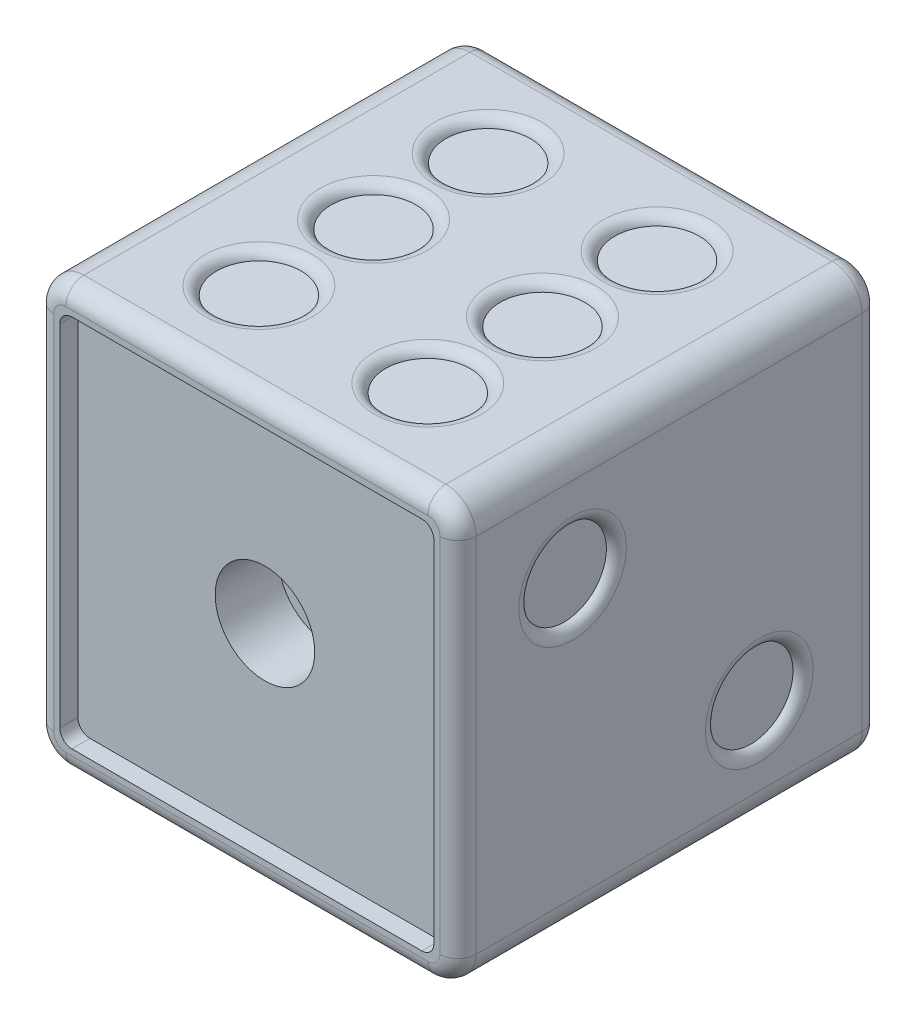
SolidWorks part; units mm, degrees
ref_plane "Front Plane" through (0, 0, 0) normal (0, 0, 1) x (1, 0, 0)
ref_plane "Top Plane" through (0, 0, 0) normal (0, 1, 0) x (1, 0, 0)
ref_plane "Right Plane" through (0, 0, 0) normal (1, 0, 0) x (0, 0, -1)
sketch "Sketch1" plane through (0, 0, 0) normal (0, 0, 1) x (1, 0, 0)
  line L1 (17.5, -17.5) -> (-17.5, -17.5)
  line L2 (17.5, -17.5) -> (17.5, 17.5)
  line L3 (17.5, 17.5) -> (-17.5, 17.5)
  line L4 (-17.5, -17.5) -> (-17.5, 17.5)
  line L5 (17.5, -17.5) -> (-17.5, 17.5) construction
  line L6 (17.5, 17.5) -> (-17.5, -17.5) construction
  point P0 (0, 0)
  dimension "D1" = 35
  dimension "D2" = 35
extrude "Boss-Extrude1" add sketch "Sketch1" along normal blind 35
sketch "Sketch2" plane through (0, 0, 35) normal (0, 0, 1) x (1, 0, 0)
  line L1 (15.5, -15.5) -> (-15.5, -15.5)
  line L2 (15.5, -15.5) -> (15.5, 15.5)
  line L3 (15.5, 15.5) -> (-15.5, 15.5)
  line L4 (-15.5, -15.5) -> (-15.5, 15.5)
  line L5 (15.5, -15.5) -> (-15.5, 15.5) construction
  line L6 (15.5, 15.5) -> (-15.5, -15.5) construction
  point P0 (0, 0)
  dimension "D1" = 31
  dimension "D2" = 31
extrude "Cut-Extrude1" cut sketch "Sketch2" against normal blind 1.5
fillet "Fillet1" radius 1 4 edges at (-15.5, -15.5, 34.25) (15.5, -15.5, 34.25) (15.5, 15.5, 34.25) (-15.5, 15.5, 34.25)
sketch "Sketch11" plane through (0, 0, 33.5) normal (0, 0, 1) x (1, 0, 0)
  circle A0 centre (0, 0) radius 4.125
  dimension "D1" = 8.25
extrude "Cut-Extrude6" cut sketch "Sketch11" against normal blind 5.25
fillet "Fillet3" radius 2.5 4 edges at (-17.5, 17.5, 17.5) (17.5, 17.5, 17.5) (17.5, -17.5, 17.5) (-17.5, -17.5, 17.5)
fillet "Fillet4" radius 1.5 16 edges at (-16.7678, -16.7678, 0) (-17.5, 0, 0) (-16.7678, 16.7678, 0) (0, 17.5, 0) (16.7678, 16.7678, 0) (17.5, 0, 0) (16.7678, -16.7678, 0) (0, -17.5, 0) (-16.7678, -16.7678, 35) (-17.5, 0, 35) (-16.7678, 16.7678, 35) (0, 17.5, 35) (16.7678, 16.7678, 35) (17.5, 0, 35) (16.7678, -16.7678, 35) (0, -17.5, 35)
sketch "Sketch13" plane through (0, -17.5, 0) normal (0, -1, 0) x (1, 0, 0)
  line L0 (-15, 17.5) -> (15, 17.5) construction
  line L1 (-15, 33.5) -> (-15, 1.5) construction
  line L2 (15, 1.5) -> (15, 33.5) construction
  circle A0 centre (0, 17.5) radius 3.5
  dimension "D1" = 7
extrude "1" cut sketch "Sketch13" against normal blind 0.7
sketch "Sketch15" plane through (0, 0, 0) normal (0, 0, -1) x (-1, 0, 0)
  line L0 (-16, 0) -> (16, 0) construction
  line L1 (-16, 15) -> (-16, -15) construction
  line L2 (16, -15) -> (16, 15) construction
  line L3 (0, 16) -> (0, -16) construction
  line L4 (15, 16) -> (-15, 16) construction
  line L5 (-15, -16) -> (15, -16) construction
  circle A0 centre (0, 0) radius 3.5
  circle A1 centre (-8, 9) radius 3.5
  circle A2 centre (-8, -9) radius 3.5
  circle A3 centre (8, -9) radius 3.5
  circle A4 centre (8, 9) radius 3.5
  dimension "D1" = 7
  dimension "D2" = 7
  dimension "D3" = 8
  dimension "D4" = 7
extrude "5" cut sketch "Sketch15" against normal blind 0.7
sketch "Sketch16" plane through (-17.5, 0, 0) normal (-1, 0, 0) x (0, 0, 1)
  line L0 (1.5, -15) -> (33.5, 15) construction
  line L1 (1.5, 15) -> (1.5, -15) construction
  line L2 (33.5, 15) -> (1.5, 15) construction
  circle A0 centre (17.5, 0) radius 3.5
  circle A1 centre (9.5, 8) radius 3.5
  circle A2 centre (24.9678, -8.499) radius 3.5
  dimension "D1" = 7
  dimension "D2" = 7
  dimension "D3" = 8
  dimension "D4" = 7
extrude "3" cut sketch "Sketch16" against normal blind 0.7
sketch "Sketch17" plane through (0, 17.5, 0) normal (0, 1, 0) x (1, 0, 0)
  line L0 (0, -1.5) -> (0, -33.5) construction
  line L1 (15, -1.5) -> (-15, -1.5) construction
  line L2 (-15, -33.5) -> (15, -33.5) construction
  line L3 (-15, -17.5) -> (15, -17.5) construction
  line L4 (-15, -1.5) -> (-15, -33.5) construction
  line L5 (15, -33.5) -> (15, -1.5) construction
  circle A0 centre (-7, -8) radius 3.5
  circle A1 centre (-7, -17.5) radius 3.5
  circle A2 centre (-7, -27) radius 3.5
  circle A3 centre (7, -27) radius 3.5
  circle A4 centre (7, -17.5) radius 3.5
  circle A5 centre (7, -8) radius 3.5
  dimension "D1" = 7
  dimension "D2" = 7
  dimension "D3" = 6.5
  dimension "D4" = 8
  dimension "D5" = 8
extrude "6" cut sketch "Sketch17" against normal blind 0.7
sketch "Sketch18" plane through (17.5, 0, 0) normal (1, 0, 0) x (0, 0, -1)
  line L0 (-1.5, 15) -> (-33.5, 15) construction
  line L1 (-33.5, 15) -> (-33.5, -15) construction
  line L2 (-1.5, 15) -> (-33.5, -15) construction
  circle A0 centre (-25.5, 8) radius 3.5
  circle A1 centre (-10.0322, -8.499) radius 3.5
  dimension "D1" = 7
  dimension "D2" = 7
  dimension "D3" = 8
extrude "4" cut sketch "Sketch18" against normal blind 0.7
fillet "Fillet5" radius 1 17 edges at (-17.5, -8.499, 21.4678) (-17.5, 0, 21) (-17.5, 8, 13) (-10.5, 17.5, 8) (10.5, 17.5, 8) (-10.5, 17.5, 17.5) (10.5, 17.5, 17.5) (-3.5, 17.5, 27) (3.5, 17.5, 27) (-4.5, 9, 0) (-11.5, -9, 0) (-3.5, 0, 0) (4.5, 9, 0) (11.5, -9, 0) (17.5, -11.999, 10.0322) (17.5, 11.5, 25.5) (3.5, -17.5, 17.5)
